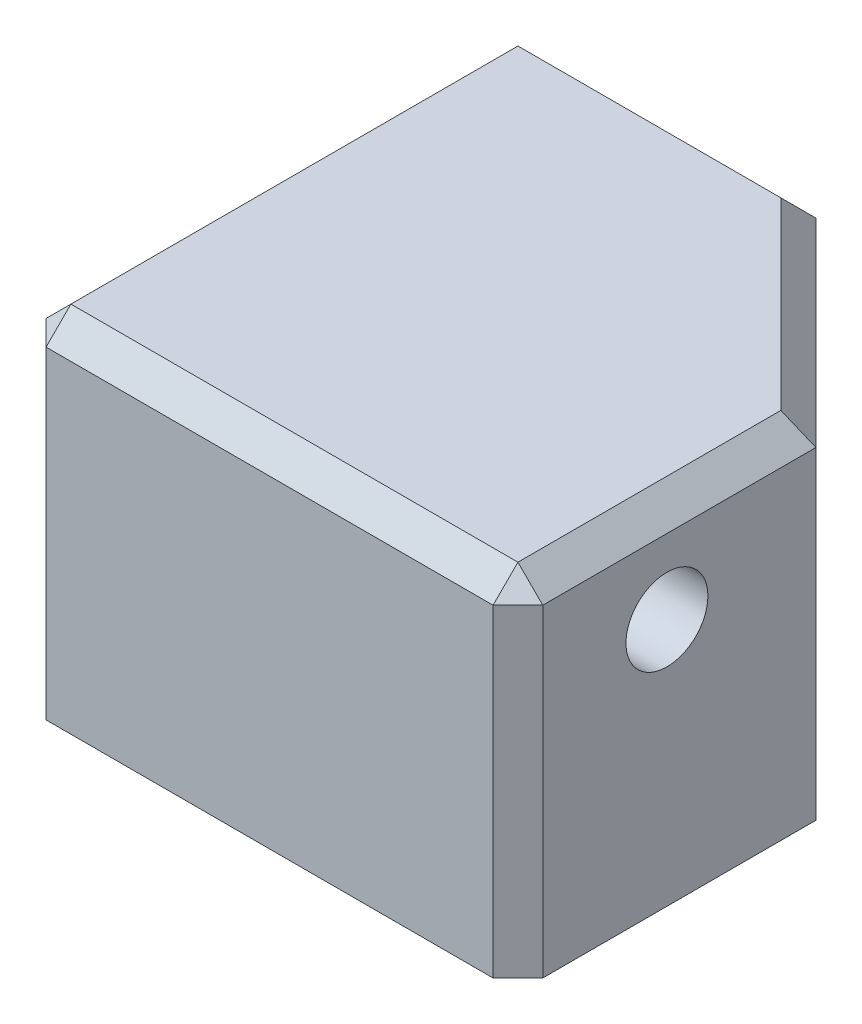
SolidWorks part; units mm, degrees
ref_plane "Front Plane" through (0, 0, 0) normal (0, 0, 1) x (1, 0, 0)
ref_plane "Top Plane" through (0, 0, 0) normal (0, 1, 0) x (1, 0, 0)
ref_plane "Right Plane" through (0, 0, 0) normal (1, 0, 0) x (0, 0, -1)
sketch "Sketch1" plane through (0, 0, 0) normal (0, 1, 0) x (1, 0, 0)
  line L0 (0, 0) -> (0, 10)
  line L1 (0, 10) -> (6, 10)
  line L2 (6, 10) -> (10, 6)
  line L3 (10, 6) -> (10, 0)
  line L4 (10, 0) -> (0, 0)
  dimension "D1" = 10
  dimension "D2" = 10
  dimension "D3" = 6
  dimension "D4" = 6
  dimension "D5" = 5.6569
  dimension "D6" = 135
extrude "Boss-Extrude1" add sketch "Sketch1" along normal blind 7
hole_wizard "Ø1.65 (1.65) Diameter Hole1" positions "Sketch3" profile "Sketch2" hole size "Ø1.65" standard "ISO"
sketch "Sketch3" plane through (10, 0, 0) normal (1, 0, 0) x (0, 0, -1)
  line L0 (0, 7) -> (0, 0) construction
  line L1 (0, 0) -> (6, 0) construction
  point P0 (3, 5)
  dimension "D1" = 3
  dimension "D2" = 5
sketch "Sketch2" plane through (10, 5, -3) normal (0, 1, 0) x (0, 0, -1)
  line L0 (0, 0) -> (0, 7.825)
  line L1 (0, 7.825) -> (0.825, 7)
  line L2 (0.825, 7) -> (0.825, 0)
  line L5 (0.825, 0) -> (0, 0)
  line L10 (0, 7.825) -> (-0.825, 7) construction
  line L11 (0, -6.35) -> (0, 107.95) construction
  dimension "Hole Dia." = 1.65
  dimension "Hole Depth" = 7
  dimension "Drill Angle" = 90
hole_wizard "Ø1.65 (1.65) Diameter Hole2" positions "Sketch5" profile "Sketch4" hole size "Ø1.65" standard "ISO"
sketch "Sketch5" plane through (0, 0, -10) normal (0, 0, -1) x (-1, 0, 0)
  line L0 (0, 7) -> (0, 0) construction
  line L1 (-6, 0) -> (0, 0) construction
  point P0 (-3, 5)
  dimension "D1" = 3
  dimension "D2" = 5
sketch "Sketch4" plane through (3, 5, -10) normal (1, 0, 0) x (0, 1, 0)
  line L0 (0, 0) -> (0, 7.825)
  line L1 (0, 7.825) -> (0.825, 7)
  line L2 (0.825, 7) -> (0.825, 0)
  line L5 (0.825, 0) -> (0, 0)
  line L10 (0, 7.825) -> (-0.825, 7) construction
  line L11 (0, -6.35) -> (0, 107.95) construction
  dimension "Hole Dia." = 1.65
  dimension "Hole Depth" = 7
  dimension "Drill Angle" = 90
hole_wizard "Ø1.65 (1.65) Diameter Hole3" positions "Sketch7" profile "Sketch6" hole size "Ø1.65" standard "ISO"
sketch "Sketch7" plane through (8, 0, -8) normal (0.7071, 0, -0.7071) x (-0.7071, 0, -0.7071)
  line L0 (-2.8284, 0) -> (2.8284, 0) construction
  point P0 (0, 5)
  dimension "D1" = 5
sketch "Sketch6" plane through (8, 5, -8) normal (0, 1, 0) x (-0.7071, 0, -0.7071)
  line L0 (0, 0) -> (0, 5.9043)
  line L1 (0, 5.9043) -> (0.825, 5.9043)
  line L2 (0.825, 5.9043) -> (0.825, 0)
  line L5 (0.825, 0) -> (0, 0)
  line L11 (0, -6.35) -> (0, 107.95) construction
  dimension "Thru Hole Dia." = 1.65
  dimension "Thru Hole Depth" = 5.9043
hole_wizard "M1.6 Tapped Hole1" positions "Sketch9" profile "Sketch8" tap size "M1.6" standard "ISO"
sketch "Sketch9" plane through (0, 0, 0) normal (0, -1, 0) x (-1, 0, 0)
  line L0 (-6, 10) -> (0, 10) construction
  line L1 (0, 10) -> (0, 0) construction
  line L2 (-10, 0) -> (-10, 6) construction
  line L3 (0, 0) -> (-10, 0) construction
  point P0 (-5.1, 8)
  point P2 (-8, 5.1)
  point P5 (-3, 10)
  point P15 (-2, 2)
  dimension "D1" = 2
  dimension "D2" = 5.1
  dimension "D3" = 2
  dimension "D4" = 5.1
  dimension "D5" = 2
  dimension "D6" = 2
sketch "Sketch8" plane through (5.1, 0, -8) normal (1, 0, 0) x (0, 0, -1)
  line L0 (0, 0) -> (0, 3.8755)
  line L1 (0, 3.8755) -> (0.625, 3.5)
  line L2 (0.625, 3.5) -> (0.625, 0)
  line L5 (0.625, 0) -> (0, 0)
  line L10 (0, 3.8755) -> (-0.625, 3.5) construction
  line L11 (0, -6.35) -> (0, 107.95) construction
  dimension "Tap Drill Dia." = 1.25
  dimension "Tap Drill Depth" = 3.5
  dimension "Drill Angle" = 118
chamfer "Chamfer1" distance 0.5 angle 45 8 edges at (10, 7, -3) (8, 7, -8) (3, 7, -10) (5, 7, 0) (0, 7, -5) (0, 3.5, 0) (10, 3.5, 0) (0, 3.5, -10)
